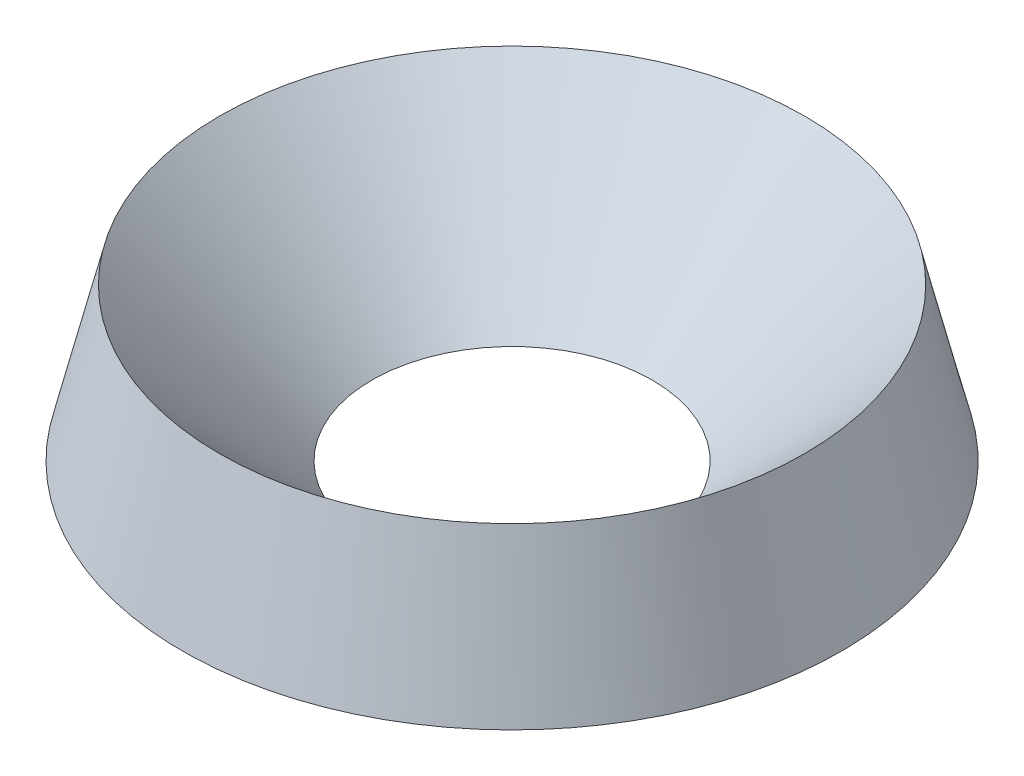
SolidWorks part; units mm, degrees
ref_plane "Plan de face" through (0, 0, 0) normal (0, 0, 1) x (1, 0, 0)
ref_plane "Plan de dessus" through (0, 0, 0) normal (0, 1, 0) x (1, 0, 0)
ref_plane "Plan de droite" through (0, 0, 0) normal (1, 0, 0) x (0, 0, -1)
sketch "Esquisse1" plane through (0, 0, 0) normal (0, 0, 1) x (1, 0, 0)
  line L0 (0, 0) -> (0, 9.8135) construction
  line L1 (8, 0) -> (3.4, 0)
  line L2 (3.4, 0) -> (7.1, 3.7)
  line L3 (7.1, 3.7) -> (8, 0)
  dimension "D1" = 6.8
  dimension "D2" = 16
  dimension "D3" = 3.7
  dimension "D4" = 45
revolve "Révolution1" add sketch "Esquisse1" angle 360 about L0
